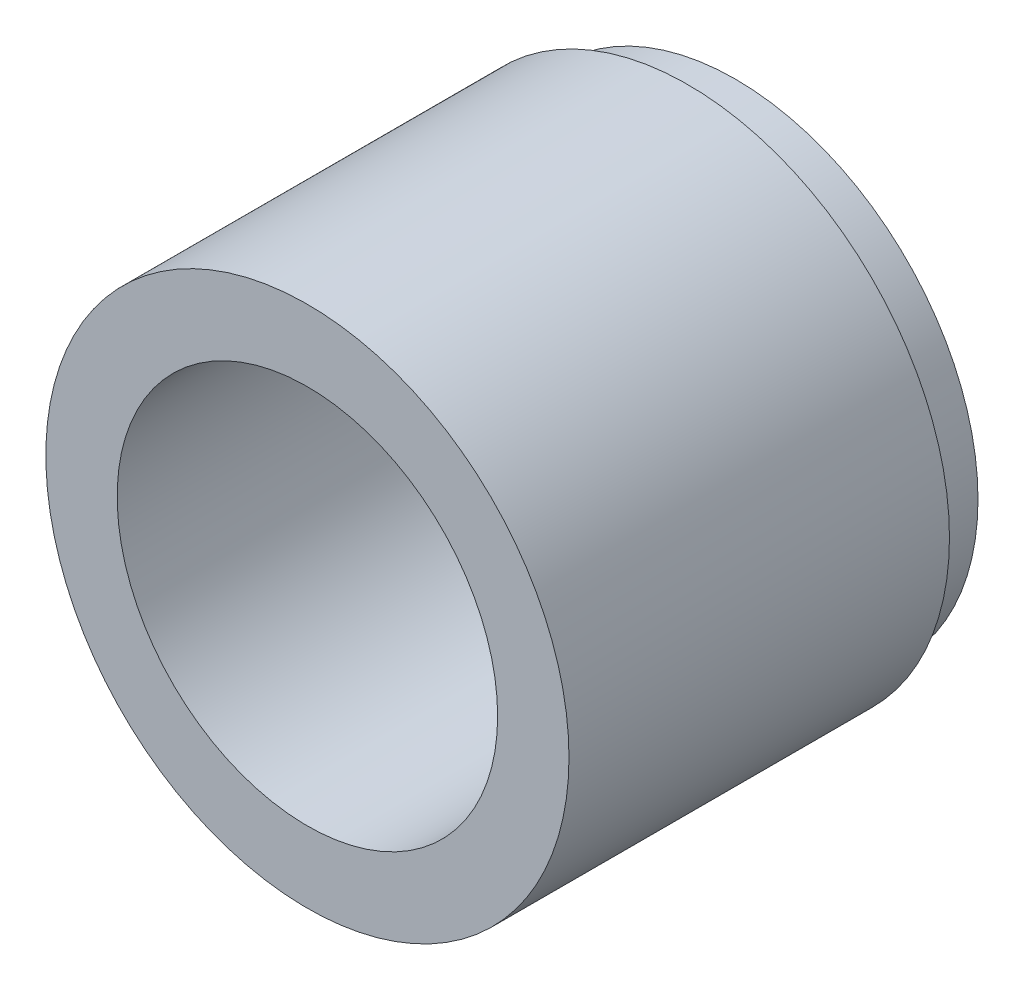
SolidWorks part; units mm, degrees
ref_plane "Front Plane" through (0, 0, 0) normal (0, 0, 1) x (1, 0, 0)
ref_plane "Top Plane" through (0, 0, 0) normal (0, 1, 0) x (1, 0, 0)
ref_plane "Right Plane" through (0, 0, 0) normal (1, 0, 0) x (0, 0, -1)
sketch "Sketch1" plane through (0, 0, 0) normal (0, 0, 1) x (1, 0, 0)
  circle A0 centre (0, 0) radius 27.5
  dimension "D1" = 55
extrude "Boss-Extrude1" add sketch "Sketch1" along normal blind 40
sketch "Sketch2" plane through (0, 0, 40) normal (0, 0, 1) x (1, 0, 0)
  circle A0 centre (0, 0) radius 20
  dimension "D1" = 40
extrude "Cut-Extrude1" cut sketch "Sketch2" against normal blind 34
sketch "Sketch3" plane through (0, 0, 0) normal (0, 0, -1) x (-1, 0, 0)
  circle A0 centre (0, 0) radius 25.5
  dimension "D1" = 51
extrude "Boss-Extrude2" add sketch "Sketch3" along normal blind 5
sketch "Sketch4" plane through (0, 0, -5) normal (0, 0, -1) x (-1, 0, 0)
  circle A0 centre (0, 0) radius 18
  dimension "D1" = 36
extrude "Cut-Extrude2" cut sketch "Sketch4" against normal blind 30
